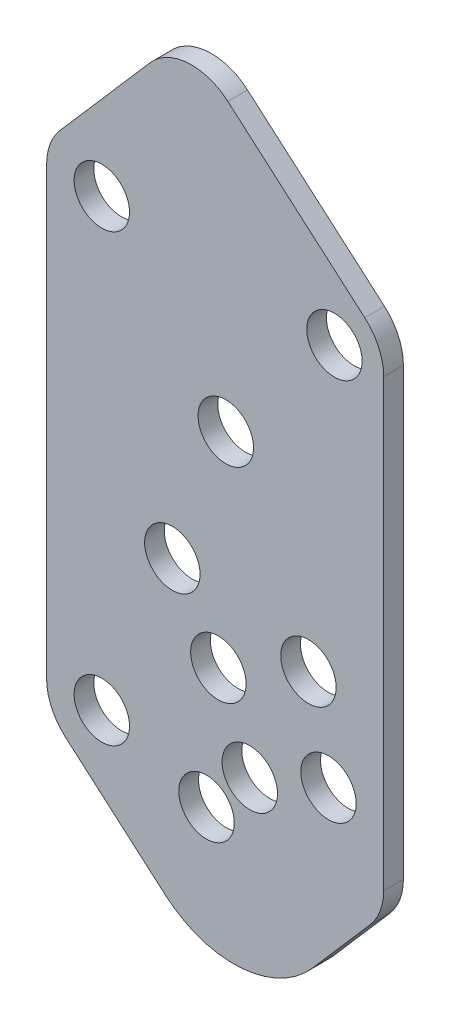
SolidWorks part; units mm, degrees
ref_plane "Front" through (0, 0, 0) normal (0, 0, 1) x (1, 0, 0)
ref_plane "Top" through (0, 0, 0) normal (0, 1, 0) x (1, 0, 0)
ref_plane "Right" through (0, 0, 0) normal (1, 0, 0) x (0, 0, -1)
ref_plane "Plane1"
sketch "Sketch1" plane through (0, 0, -29.21) normal (0, 0, 1) x (1, 0, 0)
  line L6 (-781.6416, 17.9499) -> (-799.2745, 33.2628)
  line L7 (-779.018, -45.157) -> (-779.018, 12.1965)
  line L8 (-788.2982, -58.69) -> (-780.8847, -50.1533)
  line L9 (-820.8444, -48.9285) -> (-808.0059, -60.0778)
  line L10 (-823.468, 14.1783) -> (-823.468, -43.1752)
  line L11 (-810.0242, 32.5058) -> (-821.6013, 19.1747)
  line L12 (-781.6416, 17.9499) -> (-799.2745, 33.2628)
  line L13 (-779.018, -45.157) -> (-779.018, 12.1965)
  line L14 (-788.2982, -58.69) -> (-780.8847, -50.1533)
  line L15 (-820.8444, -48.9285) -> (-808.0059, -60.0778)
  line L16 (-823.468, 14.1783) -> (-823.468, -43.1752)
  line L17 (-810.0242, 32.5058) -> (-821.6013, 19.1747)
  arc A6 (-779.018, 12.1965) -> (-781.6416, 17.9499) centre (-786.638, 12.1965) ccw
  arc A7 (-780.8847, -50.1533) -> (-779.018, -45.157) centre (-786.638, -45.157) ccw
  arc A8 (-808.0059, -60.0778) -> (-788.2982, -58.69) centre (-798.8459, -49.53) ccw
  arc A9 (-823.468, -43.1752) -> (-820.8444, -48.9285) centre (-815.848, -43.1752) ccw
  arc A10 (-821.6013, 19.1747) -> (-823.468, 14.1783) centre (-815.848, 14.1783) ccw
  arc A11 (-799.2745, 33.2628) -> (-810.0242, 32.5058) centre (-804.2709, 27.5094) ccw
  arc A12 (-779.018, 12.1965) -> (-781.6416, 17.9499) centre (-786.638, 12.1965) ccw
  arc A13 (-780.8847, -50.1533) -> (-779.018, -45.157) centre (-786.638, -45.157) ccw
  arc A14 (-808.0059, -60.0778) -> (-788.2982, -58.69) centre (-798.8459, -49.53) ccw
  arc A15 (-823.468, -43.1752) -> (-820.8444, -48.9285) centre (-815.848, -43.1752) ccw
  arc A16 (-821.6013, 19.1747) -> (-823.468, 14.1783) centre (-815.848, 14.1783) ccw
  arc A17 (-799.2745, 33.2628) -> (-810.0242, 32.5058) centre (-804.2709, 27.5094) ccw
sketch "Sketch2" plane through (0, 0, -29.21) normal (0, 0, 1) x (1, 0, 0)
  line L6 (-781.9747, 17.5663) -> (-799.6076, 32.8792)
  line L7 (-809.6407, 32.1727) -> (-821.2178, 18.8416)
  line L8 (-822.96, 14.1783) -> (-822.96, -43.1752)
  line L9 (-820.5113, -48.5449) -> (-807.6728, -59.6942)
  line L10 (-788.6817, -58.3569) -> (-781.2682, -49.8202)
  line L11 (-779.526, -45.157) -> (-779.526, 12.1965)
  line L12 (-781.9747, 17.5663) -> (-799.6076, 32.8792)
  line L13 (-809.6407, 32.1727) -> (-821.2178, 18.8416)
  line L14 (-822.96, 14.1783) -> (-822.96, -43.1752)
  line L15 (-820.5113, -48.5449) -> (-807.6728, -59.6942)
  line L16 (-788.6817, -58.3569) -> (-781.2682, -49.8202)
  line L17 (-779.526, -45.157) -> (-779.526, 12.1965)
  arc A6 (-799.6076, 32.8792) -> (-809.6407, 32.1727) centre (-804.2709, 27.5094) ccw
  arc A7 (-821.2178, 18.8416) -> (-822.96, 14.1783) centre (-815.848, 14.1783) ccw
  arc A8 (-822.96, -43.1752) -> (-820.5113, -48.5449) centre (-815.848, -43.1752) ccw
  arc A9 (-807.6728, -59.6942) -> (-788.6817, -58.3569) centre (-798.8459, -49.53) ccw
  arc A10 (-781.2682, -49.8202) -> (-779.526, -45.157) centre (-786.638, -45.157) ccw
  arc A11 (-779.526, 12.1965) -> (-781.9747, 17.5663) centre (-786.638, 12.1965) ccw
  arc A12 (-799.6076, 32.8792) -> (-809.6407, 32.1727) centre (-804.2709, 27.5094) ccw
  arc A13 (-821.2178, 18.8416) -> (-822.96, 14.1783) centre (-815.848, 14.1783) ccw
  arc A14 (-822.96, -43.1752) -> (-820.5113, -48.5449) centre (-815.848, -43.1752) ccw
  arc A15 (-807.6728, -59.6942) -> (-788.6817, -58.3569) centre (-798.8459, -49.53) ccw
  arc A16 (-781.2682, -49.8202) -> (-779.526, -45.157) centre (-786.638, -45.157) ccw
  arc A17 (-779.526, 12.1965) -> (-781.9747, 17.5663) centre (-786.638, 12.1965) ccw
extrude "Boss-Extrude1" add sketch "Sketch2" against normal blind 2.54 flip side to cut
hole_wizard "Hole1" positions "Point_Sketch" profile "Profil_Sketch" hole size "Ø0.15" standard "ISO"
sketch "Point_Sketch" plane through (-803.5274, 6.4914, -29.21) normal (0, 0, -1) x (1, 0, 0)
  point P0 (3.6543, 10.6011)
  point P2 (-3.233, 28.1775)
  point P5 (14.3066, 32.0446)
  point P8 (6.7494, 47.6684)
  point P11 (1.1726, 53.7327)
sketch "Profil_Sketch" plane through (-799.8731, -4.1097, -29.21) normal (1, 0, 0) x (0, -1, 0)
  line L0 (0, 0) -> (0, 2.54)
  line L1 (0, 2.54) -> (3.5719, 2.54)
  line L2 (3.5719, 2.54) -> (3.5719, 0)
  line L5 (3.5719, 0) -> (0, 0)
  line L11 (0, -6.35) -> (0, 107.95) construction
  dimension "Diameter" = 7.1437
  dimension "Thru Hole Depth" = 2.54
other "usin_DL090_DAYTON VERSATILE INCH VPO-50-2130-P0.1999-W0.1310 X2-0<1>"
hole_wizard "Hole11" positions "Point_Sketch1" profile "Profil_Sketch1" hole size "Ø0.15" standard "ISO"
sketch "Point_Sketch1" plane through (-804.4841, -20.3493, -29.21) normal (0, 0, -1) x (1, 0, 0)
  point P0 (3.6543, 10.6011)
sketch "Profil_Sketch1" plane through (-800.8298, -30.9504, -29.21) normal (1, 0, 0) x (0, -1, 0)
  line L0 (0, 0) -> (0, 2.54)
  line L1 (0, 2.54) -> (3.5719, 2.54)
  line L2 (3.5719, 2.54) -> (3.5719, 0)
  line L5 (3.5719, 0) -> (0, 0)
  line L11 (0, -6.35) -> (0, 107.95) construction
  dimension "Diameter" = 7.1437
  dimension "Thru Hole Depth" = 2.54
other "usin_DL090<2>"
hole_wizard "Hole12" positions "Point_Sketch2" profile "Profil_Sketch2" hole size "Ø0.15" standard "ISO"
sketch "Point_Sketch2" plane through (-819.5023, 24.7795, -29.21) normal (0, 0, -1) x (1, 0, 0)
  point P0 (3.6543, 10.6011)
  point P2 (33.6263, 12.2355)
  point P4 (32.8643, 61.9989)
  point P6 (3.6543, 67.9546)
sketch "Profil_Sketch2" plane through (-815.848, 14.1783, -29.21) normal (1, 0, 0) x (0, -1, 0)
  line L0 (0, 0) -> (0, 2.54)
  line L1 (0, 2.54) -> (3.5687, 2.54)
  line L2 (3.5687, 2.54) -> (3.5687, 0)
  line L5 (3.5687, 0) -> (0, 0)
  line L11 (0, -6.35) -> (0, 107.95) construction
  dimension "Diameter" = 7.1374
  dimension "Thru Hole Depth" = 2.54
other "usin_DL090_.25-20x1.5-SHCS<3>"
